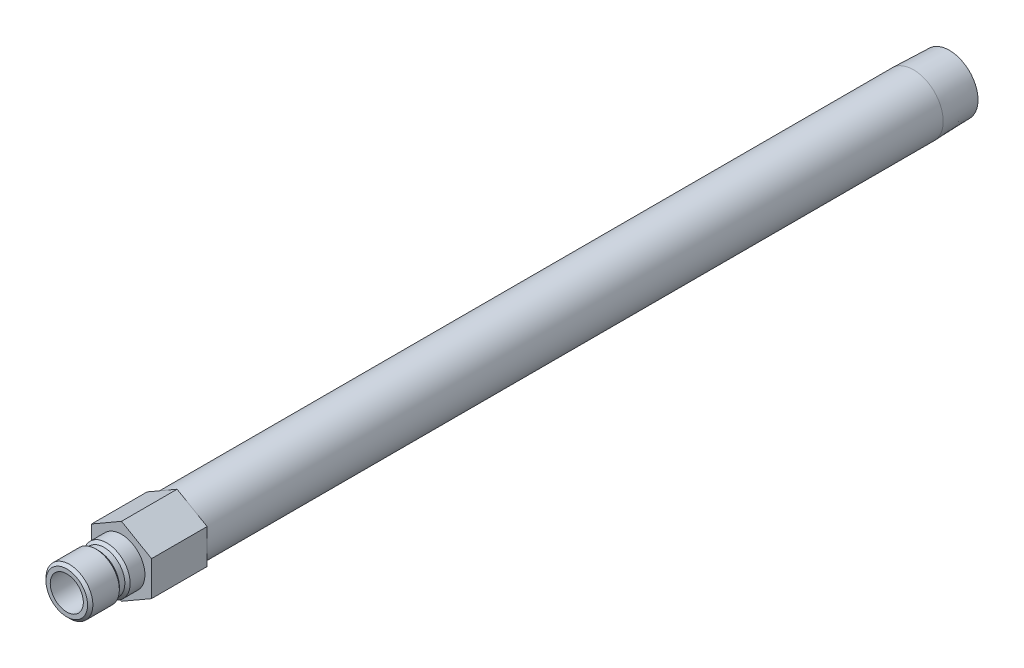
SolidWorks part; units mm, degrees
ref_plane "Front Plane" through (0, 0, 0) normal (0, 0, 1) x (1, 0, 0)
ref_plane "Top Plane" through (0, 0, 0) normal (0, 1, 0) x (1, 0, 0)
ref_plane "Right Plane" through (0, 0, 0) normal (1, 0, 0) x (0, 0, -1)
sketch "Sketch1" plane through (0, 0, 0) normal (1, 0, 0) x (0, 0, -1)
  line L0 (0, 0) -> (-18.923, 0) construction
  line L1 (-15.748, 4.7625) -> (-15.748, 5.9817)
  line L2 (-6.604, 5.9817) -> (-6.604, 0) construction
  line L3 (-14.986, 6.7437) -> (-7.366, 6.7437)
  line L4 (0, 8.5725) -> (0, 0) construction
  line L5 (-6.604, 5.9817) -> (-5.0165, 5.9817)
  line L6 (-4.2545, 6.7437) -> (0, 6.7437)
  line L7 (0, 6.7437) -> (0, 8.5725)
  line L8 (-6.604, 5.9817) -> (-7.366, 6.7437)
  line L9 (-5.0165, 5.9817) -> (-4.2545, 6.7437)
  line L10 (-15.748, 5.9817) -> (-14.986, 6.7437)
  line L11 (-15.748, 4.7625) -> (16.002, 4.7625)
  line L12 (0, 8.5725) -> (227.9142, 8.5725)
  line L13 (227.9142, 8.5725) -> (238.252, 8.2494)
  line L14 (238.252, 8.2494) -> (238.252, 6.2611)
  line L15 (0, 6.7437) -> (16.002, 6.7437) construction
  line L16 (16.002, 6.7437) -> (16.002, 0) construction
  line L17 (16.002, 0) -> (0, 0) construction
  line L18 (16.002, 4.7625) -> (16.002, 6.2611)
  line L19 (16.002, 6.2611) -> (238.252, 6.2611)
  dimension "D1" = 15.748
  dimension "D2" = 1.5875
  dimension "D3" = 0.762
  dimension "D4" = 45
  dimension "D5" = 9.144
  dimension "D6" = 45
  dimension "D7" = 1.79
  dimension "D8" = 10.3378
  dimension "D9" = 254
  dimension "D10" = 3.175
  dimension "D11" = 9.525
  dimension "D12" = 17.145
  dimension "D13" = 31.75
  dimension "D14" = 13.4874
  dimension "D15" = 12.5222
revolve "Revolve1" add sketch "Sketch1" angle 360 about L0
sketch "Sketch2" plane through (0, 0, 0) normal (0, 0, 1) x (1, 0, 0)
  line L1 (-8.636, 4.986) -> (-8.636, -4.986)
  line L2 (-8.636, -4.986) -> (0, -9.972)
  line L3 (0, -9.972) -> (8.636, -4.986)
  line L4 (8.636, -4.986) -> (8.636, 4.986)
  line L5 (8.636, 4.986) -> (0, 9.972)
  line L6 (0, 9.972) -> (-8.636, 4.986)
  circle A0 centre (0, 0) radius 8.636 construction
  circle A1 centre (0, 0) radius 4.7625 construction
  circle A2 centre (0, 0) radius 4.7625
  dimension "D1" = 17.272
extrude "Boss-Extrude1" add sketch "Sketch2" against normal up to vertex (16.002 mm away) from vertex at 0
